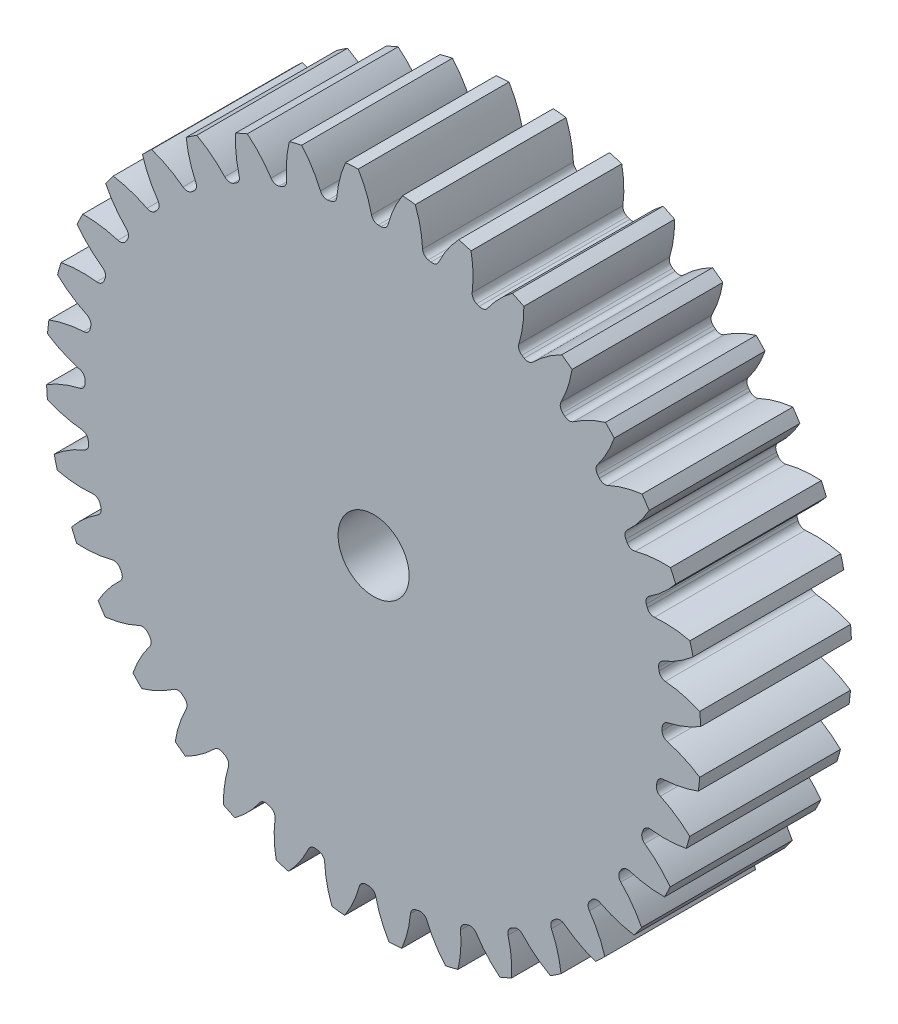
SolidWorks part; units mm, degrees
ref_plane "Front" through (0, 0, 0) normal (0, 0, 1) x (1, 0, 0)
ref_plane "Top" through (0, 0, 0) normal (0, 1, 0) x (1, 0, 0)
ref_plane "Right" through (0, 0, 0) normal (1, 0, 0) x (0, 0, -1)
sketch "Sketch3" plane through (0, 0, 0) normal (0, 0, 1) x (1, 0, 0)
  circle A0 centre (0, 0) radius 193.04
  dimension "od" = 386.08
extrude "gearBody" add sketch "Sketch3" along normal blind 88.9
sketch "Sketch2" plane through (0, 0, 0) normal (0, 0, 1) x (1, 0, 0)
  line L0 (0, 0) -> (158.7696, 65.7645) construction
  line L1 (192.491, -17.2048) -> (0, 0) construction
  line L2 (0, 0) -> (36.3143, 0) construction
  line L3 (182.833, 4.1465) -> (182.5023, -11.7473) construction
  line L5 (182.6677, -3.8004) -> (0, 0) construction
  line L7 (0, 0) -> (171.851, 0) construction
  arc A0 (171.8485, 0.9203) -> (171.6615, -8.067) centre (0, 0) ccw construction
  arc A1 (192.8275, 9.0557) -> (192.284, -17.0679) centre (0, 0) ccw construction
  arc A2 (182.833, 4.1465) -> (182.5023, -11.7473) centre (0, 0) ccw construction
  arc A3 (170.1241, -4.3606) -> (170.1583, -2.7189) centre (0, 0) ccw
  arc A4 (192.491, -17.2048) -> (173.1776, -8.4581) centre (155.897, -72.3111) ccw
  arc A5 (192.491, -17.2048) -> (193.04, 9.1839) centre (0, 0) ccw
  arc A6 (193.04, 9.1839) -> (173.3796, 1.248) centre (158.7696, 65.7645) cw
  arc A7 (170.1583, -2.7189) -> (173.3796, 1.248) centre (174.2929, -2.785) cw
  arc A8 (173.1776, -8.4581) -> (170.1241, -4.3606) centre (174.2579, -4.4666) cw
  point P6 (193.04, 9.1839)
  point P22 (192.491, -17.2048)
  dimension "baseDia" = 343.702
  dimension "od" = 386.08
  dimension "pd" = 365.76
  dimension "rd" = 340.36
  dimension "rFillet" = 4.1351
  dimension "pointX" = 193.04
  dimension "pointY" = 9.1839
  dimension "CTT" = 15.8937
  dimension "flankCenterAngle" = 22.5
extrude "toothCut" cut sketch "Sketch2" along normal through all
pattern_circular "CirPattern1" count 36 over 360 about axis through (0, 0, 0) along (0, 0, 1) of "toothCut"
sketch "hub1Dia" plane through (0, 0, 0) normal (0, 0, -1) x (-1, 0, 0)
  circle A0 centre (0, 0) radius 12.7
  dimension "hub1Dia" = 25.4
sketch "hub2Dia" plane through (0, 0, 88.9) normal (0, 0, 1) x (1, 0, 0)
  circle A0 centre (0, 0) radius 12.7
  dimension "hub2dia" = 25.4
sketch "boreDia" plane through (0, 0, 0) normal (0, 0, 1) x (1, 0, 0)
  circle A0 centre (0, 0) radius 20.955
  dimension "boreDia" = 41.91
extrude "bore" cut sketch "boreDia" against normal mid plane 25400
